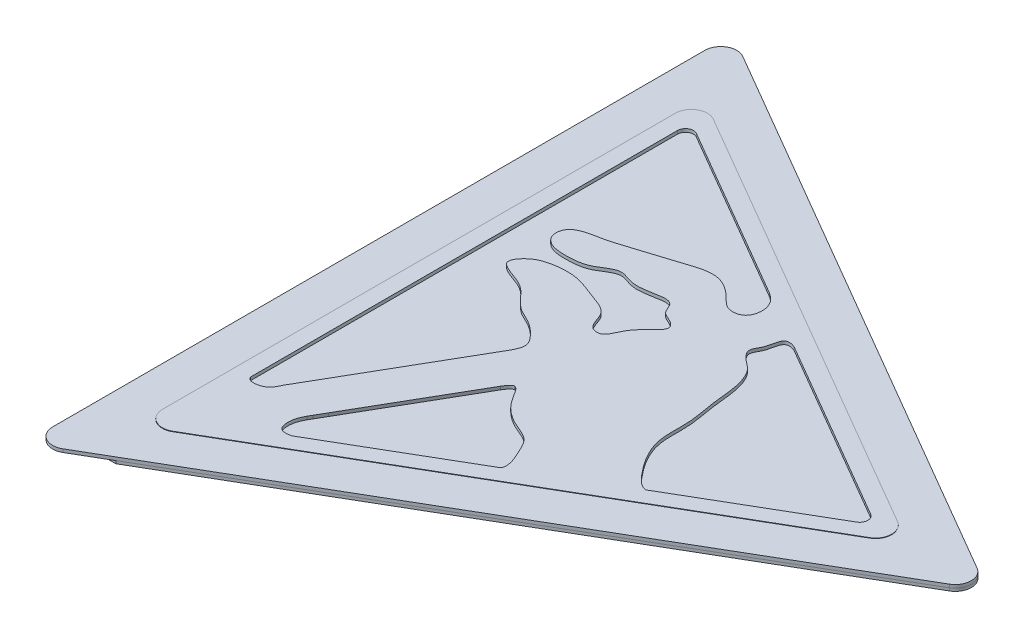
SolidWorks part; units mm, degrees
ref_plane "Vorne" through (0, 0, 0) normal (0, 0, 1) x (1, 0, 0)
ref_plane "Oben" through (0, 0, 0) normal (0, 1, 0) x (1, 0, 0)
ref_plane "Rechts" through (0, 0, 0) normal (1, 0, 0) x (0, 0, -1)
sketch "Skizze1" plane through (0, 0, 0) normal (0, 1, 0) x (1, 0, 0)
  line L0 (-15.8835, 0) -> (18.1545, 0) construction
  line L1 (0, -5.5346) -> (0, 5.5346) construction
  line L3 (-10, 10) -> (10, 10)
  line L4 (-10, 10) -> (-10, -10)
  line L5 (-10, -10) -> (10, -10)
  line L6 (10, 10) -> (10, -10)
  dimension "D1" = 20
  dimension "D2" = 20
extrude "Linear austragen1" add sketch "Skizze1" along normal blind 0.1
sketch "Skizze2" plane through (0, 0.1, 0) normal (0, 1, 0) x (-1, 0, 0)
  line L0 (-6.9428, 0.4322) -> (6.8072, 8.4322)
  line L1 (7.5587, 8) -> (7.5587, -8)
  line L2 (6.8072, -8.4322) -> (-6.9428, -0.4322)
  line L3 (7.5587, 0) -> (-7.6856, 0) construction
  line L4 (6.6829, -7.7814) -> (1.2268, -4.6069)
  line L5 (-6.3199, 0.2161) -> (-2.1587, 2.6372)
  line L6 (7.0587, 5.7469) -> (7.0587, -7.5653)
  line L7 (-6.6913, 0) -> (7.0587, 8) construction
  line L8 (7.0587, -8) -> (-6.6913, 0) construction
  line L9 (7.0587, 8) -> (7.0587, -8) construction
  line L10 (-0.5998, -3.5442) -> (-6.3199, -0.2161)
  line L11 (0.7003, 4.3006) -> (4.8161, 6.6952)
  line L12 (3.7154, 0.942) -> (6.2488, 5.333)
  line L13 (2.9077, 2.0981) -> (4.8743, 5.5068)
  line L14 (5.0532, 5.8168) -> (5.1199, 5.9325)
  arc A0 (-6.9428, 0.4322) -> (-6.9428, -0.4322) centre (-6.6913, 0) ccw
  arc A1 (7.5587, -8) -> (6.8072, -8.4322) centre (7.0587, -8) cw
  arc A2 (6.8072, 8.4322) -> (7.5587, 8) centre (7.0587, 8) cw
  arc A4 (6.6829, -7.7814) -> (7.0587, -7.5653) centre (6.8087, -7.5653) ccw
  arc A6 (-6.3199, 0.2161) -> (-6.3199, -0.2161) centre (-6.1942, 0) ccw
  arc A7 (-6.6913, 0) -> (-6.6913, 0) centre (-6.6913, 0) ccw construction
  arc A8 (7.0587, 8) -> (7.0587, 8) centre (7.0587, 8) cw construction
  arc A9 (7.0587, -8) -> (7.0587, -8) centre (7.0587, -8) cw construction
  point P2 (-0.3382, -3.5757)
  point P15 (4.9909, 5.7132)
  point P18 (2.8999, 2.0865)
  point P19 (2.7149, 1.8829)
  point P20 (2.4188, 2.1975)
  point P21 (2.0858, 2.6046)
  point P23 (1.5862, 2.9191)
  point P24 (3.7141, 0.9392)
  point P25 (3.6216, 0.6061)
  point P26 (3.8251, 0.2546)
  point P27 (4.3062, -0.1155)
  point P28 (4.6393, -0.282)
  point P29 (5.0279, -0.6521)
  point P31 (5.3795, -0.9482)
  point P32 (5.9161, -1.1702)
  point P33 (6.1566, -1.3553)
  point P34 (5.9901, -1.7068)
  point P35 (5.3992, -1.9945)
  point P36 (4.5896, -1.9993)
  point P37 (3.9377, -1.7702)
  point P39 (3.2885, -1.3923)
  point P41 (3.011, -0.8927)
  point P43 (2.7704, -0.8742)
  point P44 (-1.652, 2.253)
  point P45 (6.5629, 5.788)
  point P47 (1.1421, 3.1412)
  point P48 (-1.319, 1.7904)
  point P49 (0.883, 3.5298)
  point P50 (5.1574, 6.6754)
  point P52 (-1.0414, 1.1242)
  point P56 (-0.9962, 0.1634)
  point P58 (5.2499, 6.3238)
  point P60 (-0.8604, -0.7947)
  point P64 (-0.6755, -1.8728)
  point P68 (-0.3869, -2.2983)
  point P72 (0, -2.7616)
  point P76 (-0.1347, -3.0761)
  point P117 (2.5299, -1.2072)
  point P118 (2.1043, -1.7624)
  point P119 (1.8637, -2.1324)
  point P123 (2.0673, -2.3175)
  point P124 (2.3263, -2.4655)
  point P125 (2.4929, -2.7616)
  point P126 (3.011, -2.7986)
  point P127 (3.7326, -2.7696)
  point P128 (4.0842, -2.8646)
  point P129 (4.7318, -2.5691)
  point P130 (5.398, -2.447)
  point P131 (5.9531, -2.5395)
  point P132 (6.1566, -2.7431)
  point P133 (6.1566, -3.0761)
  point P134 (5.2684, -3.4832)
  point P135 (4.6948, -3.6498)
  point P136 (3.3995, -4.0568)
  point P137 (2.4743, -4.2234)
  point P138 (1.8082, -3.8348)
  point P139 (1.4566, -3.5572)
  point P140 (1.031, -3.6127)
  point P141 (0.883, -4.1679)
  point P142 (0.92, -4.2789)
  dimension "D1" = 0.5
  dimension "D2" = 0.5
  dimension "D3" = 16
  dimension "D4" = 14.25
  dimension "D6" = 0.25
  dimension "D5" = 0.5
extrude "Linear austragen2" add sketch "Skizze2" along normal blind 0.1
sketch "Skizze3" plane through (0, 0.1, 0) normal (0, 1, 0) x (-1, 0, 0)
  line L0 (8.8087, -8) -> (8.8087, 8) construction
  line L1 (-9.4284, -0.4322) -> (8.0572, -10.6056)
  line L2 (8.8087, -10.1734) -> (8.8087, 10.1734)
  line L3 (8.0572, 10.6056) -> (-9.4284, 0.4322)
  line L4 (-6.9428, -0.4322) -> (6.8072, -8.4322)
  line L5 (6.8072, 8.4322) -> (-6.9428, 0.4322)
  line L6 (7.5587, -8) -> (7.5587, 8)
  line L7 (-6.9428, -0.4322) -> (6.8072, -8.4322)
  line L8 (6.8072, 8.4322) -> (-6.9428, 0.4322)
  line L9 (7.5587, -8) -> (7.5587, 8)
  line L11 (6.1786, 9.5126) -> (-7.5714, 1.5126) construction
  line L13 (-7.5714, -1.5126) -> (6.1786, -9.5126) construction
  arc A1 (-9.4284, -0.4322) -> (-9.4284, 0.4322) centre (-9.177, 0) cw
  arc A2 (8.8087, 10.1734) -> (8.0572, 10.6056) centre (8.3087, 10.1734) ccw
  arc A3 (-6.9428, 0.4322) -> (-6.9428, -0.4322) centre (-6.6913, 0) ccw
  arc A4 (7.5587, 8) -> (6.8072, 8.4322) centre (7.0587, 8) ccw
  arc A5 (6.8072, -8.4322) -> (7.5587, -8) centre (7.0587, -8) ccw
  arc A6 (-6.9428, 0.4322) -> (-6.9428, -0.4322) centre (-6.6913, 0) ccw
  arc A7 (7.5587, 8) -> (6.8072, 8.4322) centre (7.0587, 8) ccw
  arc A8 (6.8072, -8.4322) -> (7.5587, -8) centre (7.0587, -8) ccw
  arc A9 (8.8087, -10.1734) -> (8.0572, -10.6056) centre (8.3087, -10.1734) cw
  arc A12 (-7.5714, 1.5126) -> (-7.5714, -1.5126) centre (-6.6913, 0) ccw construction
  arc A13 (8.8087, 8) -> (6.1786, 9.5126) centre (7.0587, 8) ccw construction
  arc A14 (6.1786, -9.5126) -> (8.8087, -8) centre (7.0587, -8) ccw construction
  dimension "D3" = 0.5
  dimension "D1" = 0
  dimension "D2" = 1.25
extrude "Linear austragen3" add sketch "Skizze3" along normal blind 0.1 separate body
sketch "Skizze4" plane through (0, 0.2, 0) normal (0, 1, 0) x (-1, 0, 0)
  line L3 (-9.4284, -0.4322) -> (8.0572, -10.6056)
  line L4 (8.8087, -10.1734) -> (8.8087, 10.1734)
  line L5 (8.0572, 10.6056) -> (-9.4284, 0.4322)
  line L6 (-9.4284, -0.4322) -> (8.0572, -10.6056)
  line L7 (8.8087, -10.1734) -> (8.8087, 10.1734)
  line L8 (8.0572, 10.6056) -> (-9.4284, 0.4322)
  arc A3 (-9.4284, 0.4322) -> (-9.4284, -0.4322) centre (-9.177, 0) ccw
  arc A4 (-9.4284, 0.4322) -> (-9.4284, -0.4322) centre (-9.177, 0) ccw
  arc A5 (8.0572, -10.6056) -> (8.8087, -10.1734) centre (8.3087, -10.1734) ccw
  arc A6 (8.0572, -10.6056) -> (8.8087, -10.1734) centre (8.3087, -10.1734) ccw
  arc A7 (8.8087, 10.1734) -> (8.0572, 10.6056) centre (8.3087, 10.1734) ccw
  arc A8 (8.8087, 10.1734) -> (8.0572, 10.6056) centre (8.3087, 10.1734) ccw
  dimension "D1" = 0
extrude "Schnitt-Linear austragen2" cut sketch "Skizze4" against normal through all flip side to cut
scale "Skalieren1" bodies to scale 104 103 scale about centroid uniform scaling yes scale factor 1.1
